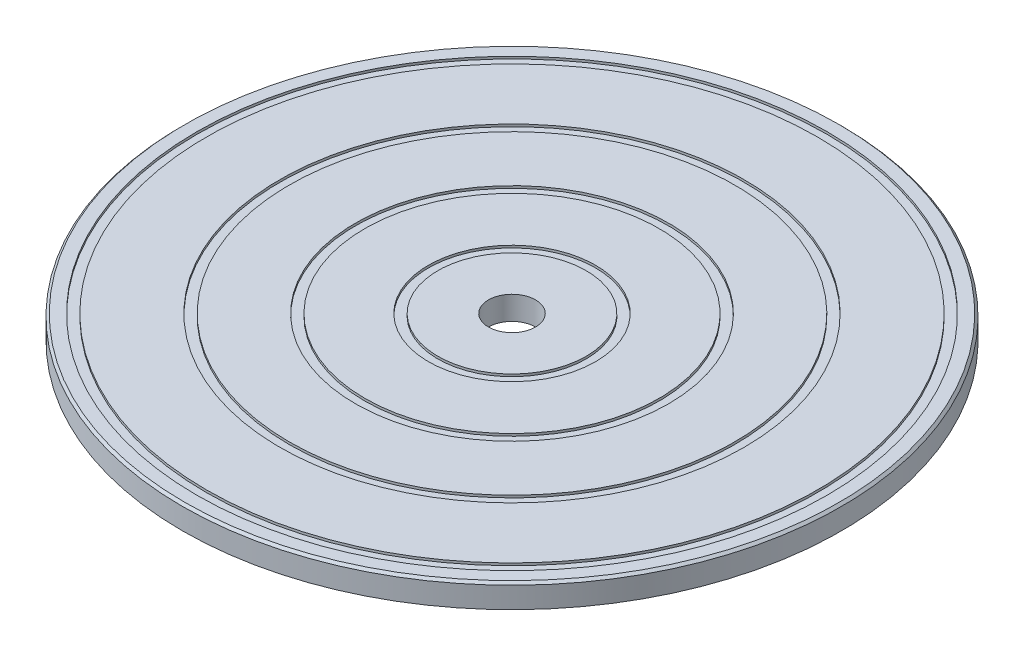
SolidWorks part; units mm, degrees
ref_plane "Front Plane" through (0, 0, 0) normal (0, 0, 1) x (1, 0, 0)
ref_plane "Top Plane" through (0, 0, 0) normal (0, 1, 0) x (1, 0, 0)
ref_plane "Right Plane" through (0, 0, 0) normal (1, 0, 0) x (0, 0, -1)
sketch "Sketch1" plane through (0, 0, 0) normal (0, 1, 0) x (1, 0, 0)
  circle A0 centre (0, 0) radius 70
  circle A1 centre (0, 0) radius 5
  dimension "D1" = 10
  dimension "D2" = 140
extrude "Boss-Extrude1" add sketch "Sketch1" along normal blind 5
sketch "Sketch2" plane through (0, 5, 0) normal (0, 1, 0) x (1, 0, 0)
  circle A0 centre (0, 0) radius 16.7569
extrude "Cut-Extrude-Thin1" cut sketch "Sketch2" against normal blind 0.5 thin
sketch "Sketch3" plane through (0, 5, 0) normal (0, 1, 0) x (1, 0, 0)
  circle A0 centre (0, 0) radius 31.2548
extrude "Cut-Extrude-Thin2" cut sketch "Sketch3" against normal blind 0.5 thin
sketch "Sketch4" plane through (0, 5, 0) normal (0, 1, 0) x (1, 0, 0)
  circle A0 centre (0, 0) radius 47.2863
extrude "Cut-Extrude-Thin3" cut sketch "Sketch4" against normal blind 0.5 thin
sketch "Sketch5" plane through (0, 5, 0) normal (0, 1, 0) x (1, 0, 0)
  circle A0 centre (0, 0) radius 64.9115
extrude "Cut-Extrude-Thin4" cut sketch "Sketch5" against normal blind 0.5 thin
chamfer "Chamfer1" distance 0.5 angle 45 1 edges at (0, 5, 70)
